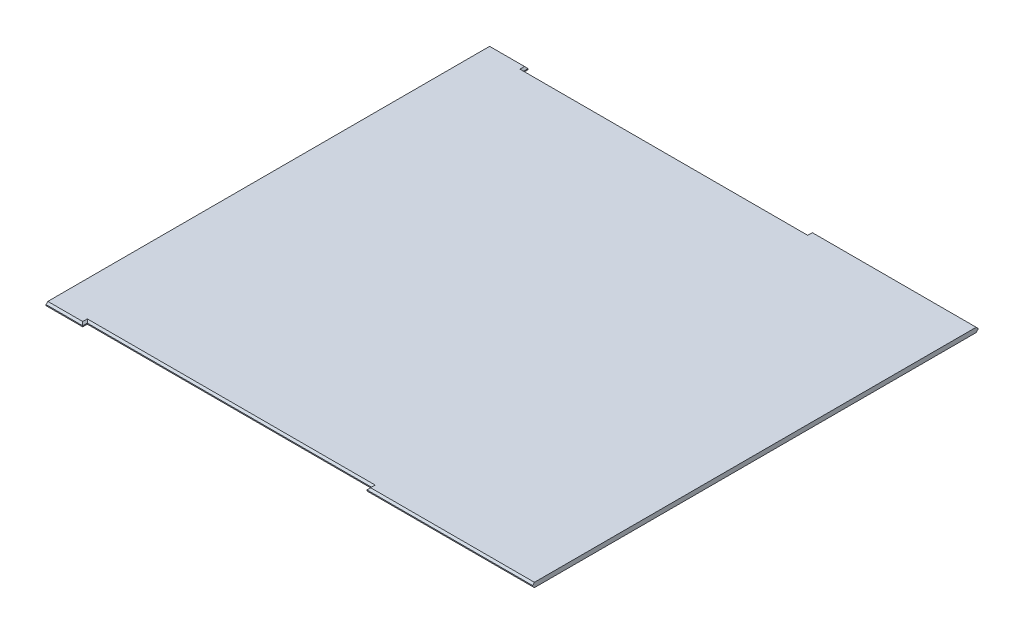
SolidWorks part; units mm, degrees
ref_plane "Front Plane" through (0, 0, 0) normal (1, 0, 0) x (0, 1, 0)
ref_plane "Top Plane" through (0, 0, 0) normal (0, 0, 1) x (0, 1, 0)
ref_plane "Right Plane" through (0, 0, 0) normal (0, 1, 0) x (-1, 0, 0)
sketch "Sketch2"
sketch_block_instance "Block4-1"
sketch_block "Block4"
extrude "Boss-Extrude2" add sketch "Sketch2" along normal mid plane 12.7
chamfer "Chamfer1" distance 5 angle 45 20 edges at (-612.5735, -6.35, -568.6517) (-562.5735, -6.35, -562.3892) (-175.5735, -6.35, -556.1267) (211.4265, -6.35, -562.3892) (437.0265, -6.35, -568.6517) (-612.5735, 6.35, -568.6517) (-562.5735, 6.35, -562.3892) (-175.5735, 6.35, -556.1267) (437.0265, 6.35, -568.6517) (211.4265, 6.35, -562.3892) (-612.5735, -6.35, 644.5483) (-562.5735, -6.35, 638.2858) (-175.5735, -6.35, 632.0233) (211.4265, -6.35, 638.2858) (437.0265, -6.35, 644.5483) (-612.5735, 6.35, 644.5483) (-562.5735, 6.35, 638.2858) (-175.5735, 6.35, 632.0233) (211.4265, 6.35, 638.2858) (437.0265, 6.35, 644.5483)
